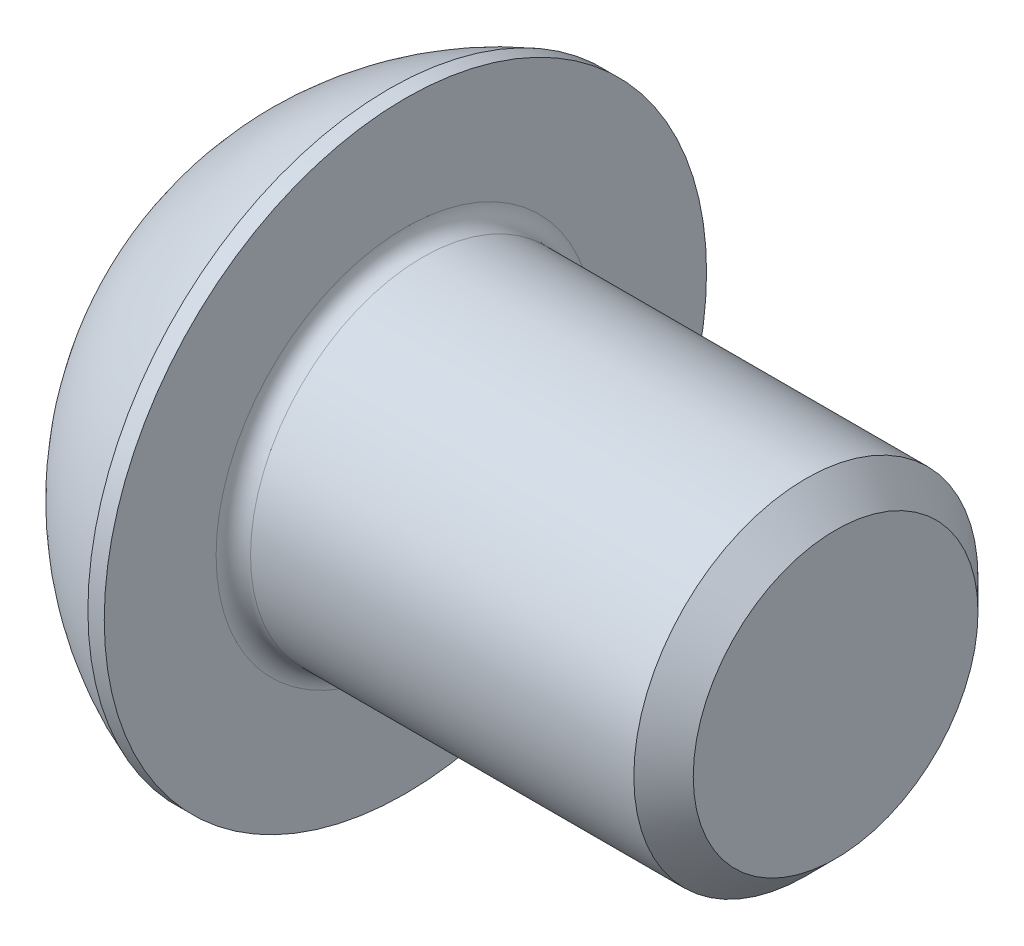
SolidWorks part; units mm, degrees
ref_plane "Plane1" through (0, 0, 0) normal (0, 0, 1) x (1, 0, 0)
ref_plane "Plane2" through (0, 0, 0) normal (0, 1, 0) x (1, 0, 0)
ref_plane "Plane3" through (0, 0, 0) normal (1, 0, 0) x (0, 0, -1)
sketch "BodySke" plane through (0, 0, 0) normal (0, 0, 1) x (1, 0, 0)
  line L0 (14.4, 0) -> (14.4, 3.3095)
  line L1 (13.7095, 4) -> (4.4, 4)
  line L2 (4.4, 4) -> (4.4, 7)
  line L3 (4.4, 7) -> (4.02, 7)
  line L4 (0, 0) -> (101.6, 0) construction
  line L5 (4.4, -7) -> (4.02, -7) construction
  line L6 (55.6768, -4) -> (4.4, -4) construction
  line L7 (14.4, 0) -> (0, 0)
  line L8 (0, 3.5) -> (0, -3.5) construction
  line L9 (0, 0) -> (0, 3.5)
  line L10 (14.4, 3.3095) -> (13.7095, 4)
  line L11 (14.4, -3.3095) -> (13.7095, -4) construction
  line L12 (5.65, 9.525) -> (5.65, -4) construction
  line L13 (4.4, 9.525) -> (4.4, -4) construction
  arc A1 (0, 3.5) -> (4.02, 7) centre (6.5809, 0) cw
revolve "BaseBody" add sketch "BodySke" angle 360 about L4
fillet "Fillet1" radius 0.4 1 edges at (4.4, 0, 4)
sketch "Sketch2" plane through (0, 0, 0) normal (0, 0, 1) x (1, 0, 0)
  line L0 (0, 2.5) -> (2.6, 2.5)
  line L1 (2.6, 2.5) -> (4.0434, 0)
  line L3 (4.0434, 0) -> (0, 0)
  line L4 (0, 0) -> (0, 2.5)
  line L5 (0, -2.5) -> (2.6, -2.5) construction
  line L6 (0, 0) -> (47.625, 0) construction
  dimension "D2" = 60
  dimension "PreBroach_depth" = 2.6
  dimension "PreBroach_dia" = 5
revolve "PreBroach" cut sketch "Sketch2" angle 360 about L6
sketch "Sketch3" plane through (0, 0, 0) normal (1, 0, 0) x (0, 0, -1)
  line L0 (-2.5, -1.4434) -> (-2.5, 1.4434)
  line L1 (-2.5, 1.4434) -> (0, 2.8868)
  line L2 (0, 2.8868) -> (2.5, 1.4434)
  line L3 (2.5, 1.4434) -> (2.5, -1.4434)
  line L4 (2.5, -1.4434) -> (0, -2.8868)
  line L5 (0, -2.8868) -> (-2.5, -1.4434)
extrude "Hex" cut sketch "Sketch3" along normal blind 2.6
sketch "ThdSchSke" plane through (0, 0, 0) normal (0, 0, 1) x (1, 0, 0)
  line L0 (6.9, -3.3095) -> (6.4165, -4)
  line L1 (6.9, -3.3095) -> (7.3835, -4)
  line L2 (7.3835, -4) -> (7.3835, -5)
  line L3 (-3.175, 0) -> (5.1513, 0) construction
  line L5 (7.3835, -5) -> (6.4165, -5)
  line L6 (6.4165, -5) -> (6.4165, -4)
revolve "ThreadSchematic" [suppressed] cut sketch "ThdSchSke" angle 360 about L3
pattern_linear "ThdSchPat" [suppressed]
thread "Filetage1" pitch 1.25 start angle 0, offset 5, length 0, pitch 1.25, diameter 8
ref_plane "Plan1" through (18.7095, 0, 4) normal (0, -1, 0) x (0, 0, 1)
sketch "Profil de filetage1" plane through (18.7095, 0, 4) normal (0, -1, 0) x (0, 0, 1)
  line L0 (0, 0) -> (0, 1.25) construction
  line L11 (0, 0) -> (0, 1.0937)
  line L12 (0, 1.0937) -> (-0.6766, 0.7031)
  line L13 (-0.6766, 0.7031) -> (-0.6766, 0.3906)
  line L15 (-0.6766, 0.3906) -> (0, 0)
  line L17 (-0.6766, 0.5469) -> (0, 0.5469) construction
  point P2 (0, 0)
  dimension "Pitch" = 1.25
  dimension "Profile_Angle" = 60
  dimension "Profile_Land" = 0.3125
  dimension "Profile_Height" = 0.6766
equation "\"D1@BodySke\" = \"Head_dia@BodySke\" * .5"
equation "\"D1@Sketch3\" = \"Hex_size@Sketch3\" / 2"
equation "\"D2@Sketch3\" = \"D1@Sketch3\""
equation "\"D3@Sketch3\" = \"Hex_size@Sketch3\""
equation "\"Thread_minor@ThdSchSke\" = \"Minor_dia@BodySke\""
equation "\"Diameter@ThdSchSke\" = \"Diameter@BodySke\""
equation "\"Overcut@ThdSchSke\" = \"Diameter@BodySke\" * 1.25"
